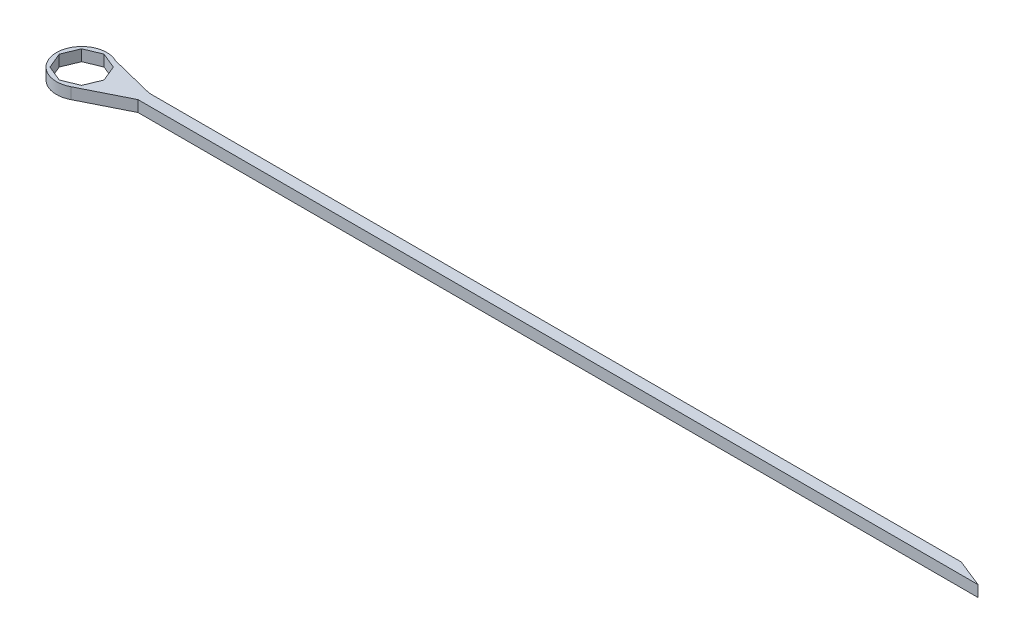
SolidWorks part; units mm, degrees
ref_plane "Front Plane" through (0, 0, 0) normal (0, 0, 1) x (1, 0, 0)
ref_plane "Top Plane" through (0, 0, 0) normal (0, 1, 0) x (1, 0, 0)
ref_plane "Right Plane" through (0, 0, 0) normal (1, 0, 0) x (0, 0, -1)
sketch "Sketch1" plane through (0, 0, 0) normal (0, 1, 0) x (1, 0, 0)
  line L0 (5.0308, 0) -> (80, 0)
  line L2 (2, 0) -> (1.4142, 1.4142)
  line L3 (1.4142, 1.4142) -> (0, 2)
  line L4 (0, 2) -> (-1.4142, 1.4142)
  line L5 (-1.4142, 1.4142) -> (-2, 0)
  line L6 (-2, 0) -> (-1.4142, -1.4142)
  line L7 (-1.4142, -1.4142) -> (0, -2)
  line L8 (0, -2) -> (1.4142, -1.4142)
  line L9 (1.4142, -1.4142) -> (2, 0)
  line L10 (80, 0) -> (77.5, 1)
  line L11 (77.5, 1) -> (5.0308, 1)
  line L12 (5.0308, 1) -> (1.0308, 2)
  line L13 (5.0308, 0) -> (1.0308, -2)
  arc A0 (1.0308, 2) -> (1.0308, -2) centre (0, 0) ccw
  circle A1 centre (0, 0) radius 2 construction
  dimension "D1" = 4.5
  dimension "D2" = 4
  dimension "D3" = 1
  dimension "D4" = 2.5
  dimension "D5" = 2
  dimension "D6" = 4
  dimension "D7" = 80
  dimension "D8" = 2
extrude "Boss-Extrude1" add sketch "Sketch1" along normal blind 1
sketch "Sketch2" plane through (0, 1, 0) normal (0, 1, 0) x (1, 0, 0)
  line L0 (0, 0) -> (16, 0)
  line L1 (5.0308, 0) -> (80, 0) construction
  line L2 (16, 0) -> (23.6429, 0)
  line L3 (23.6429, 0) -> (31.2857, 0)
  line L4 (31.2857, 0) -> (38.9286, 0)
  line L5 (38.9286, 0) -> (46.5714, 0)
  line L6 (46.5714, 0) -> (54.2143, 0)
  line L7 (54.2143, 0) -> (61.8571, 0)
  line L8 (61.8571, 0) -> (69.5, 0)
  line L10 (69.5, 0) -> (77.5, 0)
  dimension "D1" = 16
  dimension "D2" = 8
